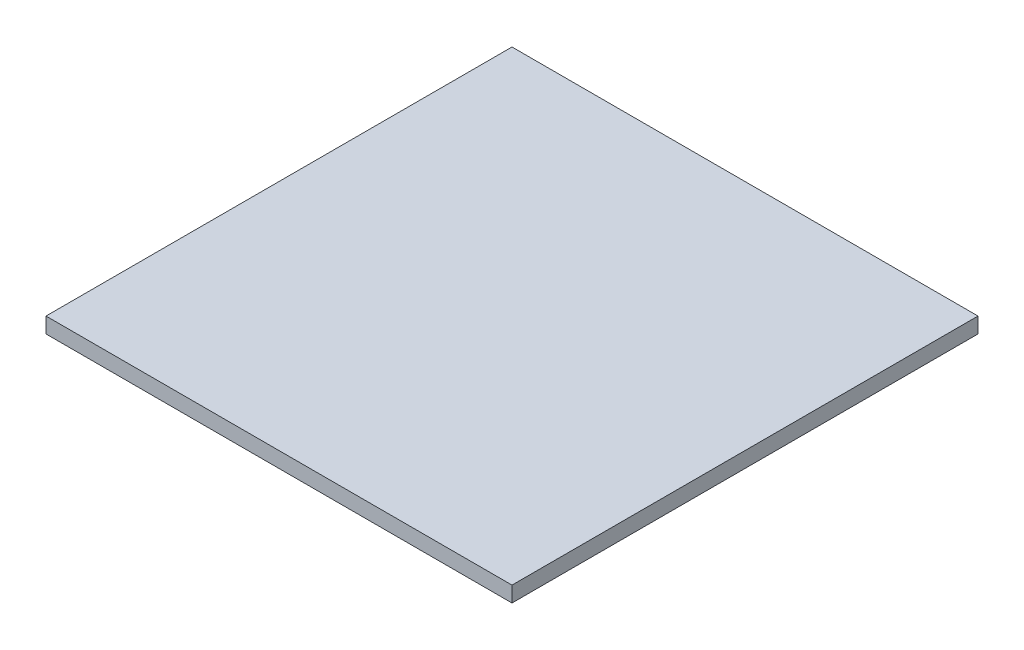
SolidWorks part; units mm, degrees
ref_plane "Front" through (0, 0, 0) normal (0, 0, 1) x (1, 0, 0)
ref_plane "Top" through (0, 0, 0) normal (0, 1, 0) x (1, 0, 0)
ref_plane "Right" through (0, 0, 0) normal (1, 0, 0) x (0, 0, -1)
sketch "Sketch1" plane through (0, 0, 0) normal (0, 1, 0) x (1, 0, 0)
  line L1 (152.4, 152.4) -> (-152.4, 152.4)
  line L2 (152.4, 152.4) -> (152.4, -152.4)
  line L3 (152.4, -152.4) -> (-152.4, -152.4)
  line L4 (-152.4, 152.4) -> (-152.4, -152.4)
  line L5 (152.4, 152.4) -> (-152.4, -152.4) construction
  line L6 (152.4, -152.4) -> (-152.4, 152.4) construction
  point P0 (0, 0)
  dimension "D1" = 304.8
  dimension "D2" = 304.8
extrude "Boss-Extrude1" add sketch "Sketch1" along normal blind 10.16
